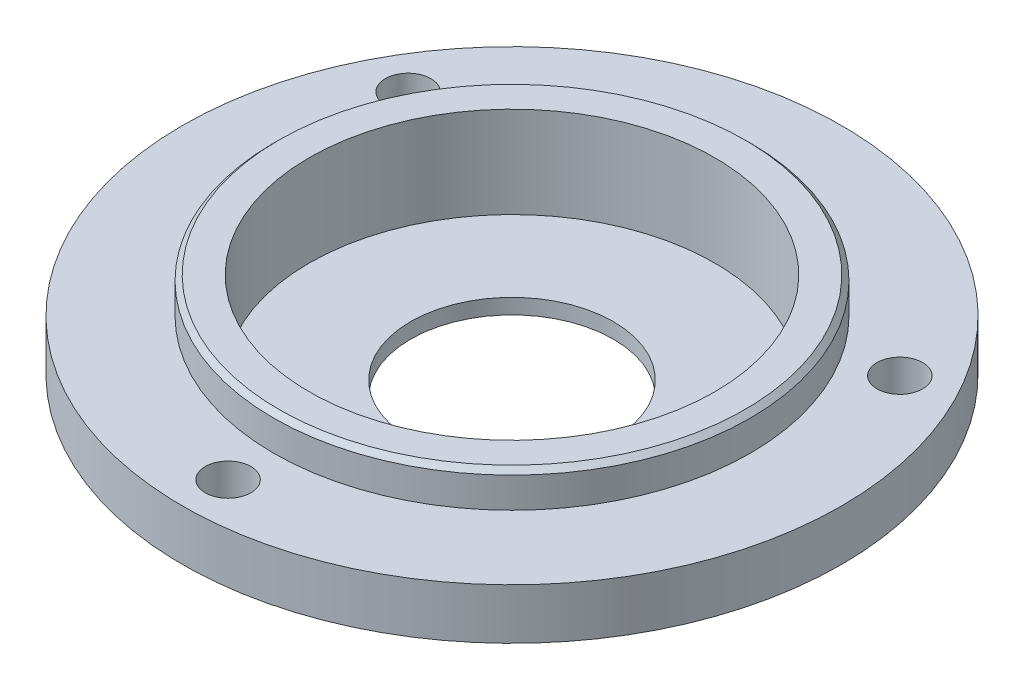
SolidWorks part; units mm, degrees
ref_plane "Plan de face" through (0, 0, 0) normal (0, 0, 1) x (1, 0, 0)
ref_plane "Plan de dessus" through (0, 0, 0) normal (0, 1, 0) x (1, 0, 0)
ref_plane "Plan de droite" through (0, 0, 0) normal (1, 0, 0) x (0, 0, -1)
sketch "Esquisse1" plane through (0, 0, 0) normal (0, 0, 1) x (1, 0, 0)
  line L0 (0, 39.1071) -> (0, -39.828) construction
  line L1 (-10, -7) -> (-10, -5.5)
  line L2 (-10, -5.5) -> (-20, -5.5)
  line L3 (-20, -5.5) -> (-20, 3.5)
  line L4 (-20, 3.5) -> (-23, 3.5)
  line L5 (-23.5, 3) -> (-23.5, 0)
  line L6 (-23.5, 0) -> (-32.5, 0)
  line L7 (-32.5, 0) -> (-32.5, -5)
  line L8 (-32.5, -5) -> (-22, -5)
  line L9 (-22, -5) -> (-22, -7)
  line L10 (-22, -7) -> (-10, -7)
  line L11 (-23, 3.5) -> (-23.5, 3)
  point P5 (-23.5, 3.5)
  dimension "D1" = 47
  dimension "D2" = 20
  dimension "D3" = 65
  dimension "D4" = 40
  dimension "D5" = 3.5
  dimension "D6" = 5
  dimension "D7" = 9
  dimension "D8" = 7
  dimension "D9" = 22
  dimension "D10" = 0.5
  dimension "D11" = 45
revolve "Révolution1" add sketch "Esquisse1" angle 360 about L0
sketch "Esquisse2" plane through (0, 0, 0) normal (0, 1, 0) x (-1, 0, 0)
  circle A0 centre (0, 28) radius 2.25
  dimension "D1" = 4.5
  dimension "D2" = 28
extrude "Enlèv. mat.-Extru.1" cut sketch "Esquisse2" against normal through all
pattern_circular "Répétition circulaire1" count 3 every 120 about axis through (0, 0, 0) along (0, 1, 0) of "Enlèv. mat.-Extru.1"
